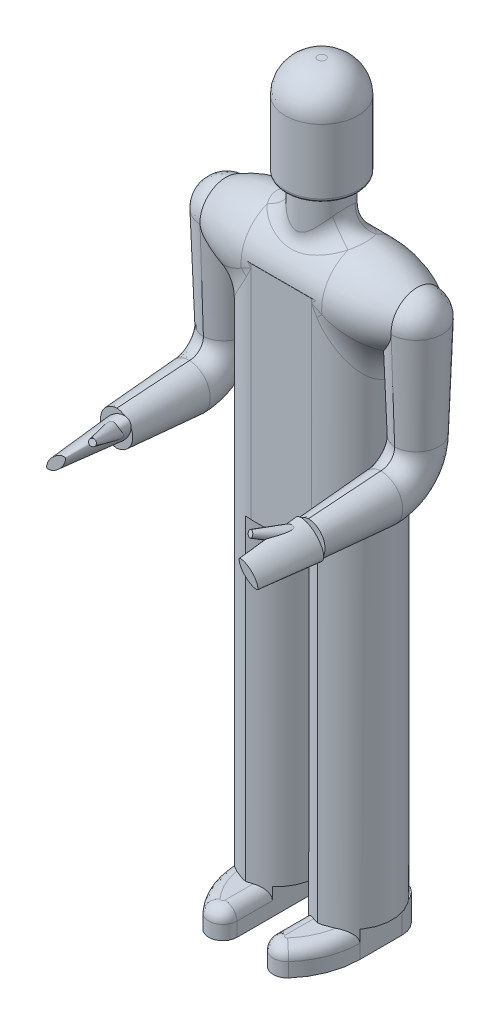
SolidWorks part; units mm, degrees
ref_plane "Front" through (0, 0, 0) normal (0, 0, 1) x (1, 0, 0)
ref_plane "Top" through (0, 0, 0) normal (0, 1, 0) x (1, 0, 0)
ref_plane "Right" through (0, 0, 0) normal (1, 0, 0) x (0, 0, -1)
sketch "Sketch1" plane through (0, 0, 0) normal (0, 1, 0) x (1, 0, 0)
  line L0 (-75, 100) -> (75, 100)
  line L2 (75, -100) -> (-75, -100)
  line L4 (0, -100) -> (0, 100) construction
  arc A0 (75, -100) -> (75, 100) centre (75, 0) ccw
  arc A1 (-75, 100) -> (-75, -100) centre (-75, 0) ccw
  dimension "D2" = 350
  dimension "D1" = 200
extrude "Base-Extrude" add sketch "Sketch1" along normal blind 550
sketch "Sketch3" plane through (0, 0, 0) normal (0, -1, 0) x (1, 0, 0)
  line L2 (-75, -100) -> (75, -100)
  line L3 (75, 100) -> (-75, 100)
  line L4 (-75, -100) -> (75, -100)
  line L5 (75, 100) -> (-75, 100)
  arc A2 (-75, 100) -> (-75, -100) centre (-75, 0) ccw
  arc A3 (75, -100) -> (75, 100) centre (75, 0) ccw
  arc A4 (-75, 100) -> (-75, -100) centre (-75, 0) ccw
  arc A5 (75, -100) -> (75, 100) centre (75, 0) ccw
  dimension "D1" = 0
extrude "Boss-Extrude2" add sketch "Sketch3" along normal blind 850
sketch "Sketch6" plane through (0, 0, 0) normal (1, 0, 0) x (0, 0, -1)
  line L0 (100, -850) -> (-200, -850)
  line L1 (100, -850) -> (100, -785)
  line L2 (-200, -785) -> (100, -785)
  line L3 (-200, -785) -> (-200, -850)
  dimension "D1" = 300
  dimension "D2" = 65
extrude "Boss-Extrude3" add sketch "Sketch6" along normal mid plane 350
sketch "Sketch7" plane through (0, -785, 0) normal (0, 1, 0) x (-1, 0, 0)
  line L0 (0, -100) -> (0, 200) construction
  line L1 (75, -100) -> (-75, -100) construction
  line L2 (-175, 200) -> (175, 200) construction
  line L3 (-45, -45) -> (-45, 165)
  line L4 (-155, 60) -> (-155, -45)
  line L5 (-175, -100) -> (-75, -100) construction
  line L6 (-175, 200) -> (-175, 0) construction
  line L7 (155, 60) -> (155, -45)
  line L8 (45, -45) -> (45, 165)
  line L13 (-185, 210) -> (185, 210)
  line L14 (185, 210) -> (185, -110)
  line L15 (185, -110) -> (-185, -110)
  line L16 (-185, -110) -> (-185, 210)
  line L17 (-185, 210) -> (185, 210)
  line L18 (185, 210) -> (185, -110)
  line L19 (185, -110) -> (-185, -110)
  line L20 (-185, -110) -> (-185, 210)
  arc A0 (-45, 165) -> (-106.1287, 188.2871) centre (-80, 165) ccw
  arc A1 (-45, -45) -> (-155, -45) centre (-100, -45) cw
  arc A2 (-106.1287, 188.2871) -> (-155, 60) centre (37.8125, 60) ccw
  arc A3 (-75, 100) -> (-75, -100) centre (-75, 0) ccw construction
  arc A4 (106.1287, 188.2871) -> (155, 60) centre (-37.8125, 60) cw
  arc A5 (45, -45) -> (155, -45) centre (100, -45) ccw
  arc A6 (45, 165) -> (106.1287, 188.2871) centre (80, 165) cw
  dimension "D3" = 35
  dimension "D1" = 110
  dimension "D2" = 20
  dimension "D4" = 10
extrude "Cut-Extrude5" cut sketch "Sketch7" against normal blind 350
sketch "Sketch8" plane through (0, -785, 0) normal (0, -1, 0) x (1, 0, 0)
  line L0 (182.7532, 150.6065) -> (-185.8298, 150.6065)
  line L1 (182.7532, 150.6065) -> (182.7532, -133.0608)
  line L2 (-185.8298, -133.0608) -> (182.7532, -133.0608)
  line L3 (-185.8298, -133.0608) -> (-185.8298, 150.6065)
  line L4 (0, 60) -> (0, -60) construction
  arc A0 (151.4344, -64.4809) -> (155, 60) centre (75, 0) ccw construction
  arc A1 (151.4344, -64.4809) -> (155, 60) centre (75, 0) ccw
  arc A2 (155, 60) -> (75, 100) centre (75, 0) ccw construction
  arc A3 (155, 60) -> (89.3675, 98.9625) centre (75, 0) ccw
  arc A4 (89.3675, -98.9625) -> (151.4344, -64.4809) centre (75, 0) ccw construction
  arc A5 (96.4627, -97.6696) -> (151.4344, -64.4809) centre (75, 0) ccw
  arc A6 (89.3675, 98.9625) -> (96.4627, -97.6696) centre (110.1372, 1.2679) ccw
  arc A7 (-89.3675, 98.9625) -> (-96.4627, -97.6696) centre (-110.1372, 1.2679) cw
  arc A8 (-96.4627, -97.6696) -> (-151.4344, -64.4809) centre (-75, 0) cw
  arc A9 (-155, 60) -> (-89.3675, 98.9625) centre (-75, 0) cw
  arc A10 (-151.4344, -64.4809) -> (-155, 60) centre (-75, 0) cw
extrude "Cut-Extrude6" cut sketch "Sketch8" against normal blind 785
fillet "Fillet1" radius 30
ref_plane "Plane4" through (0, 540, 0) normal (0, 1, 0) x (-1, 0, 0)
sketch "Sketch9" plane through (0, 540, 0) normal (0, 1, 0) x (-1, 0, 0)
  line L1 (100, -100) -> (-100, -100)
  line L3 (0, -130.4557) -> (0, 0) construction
  line L4 (-52.4051, 0) -> (194.5823, 0) construction
  line L5 (-300, 0) -> (300, 0)
  arc A0 (300, 0) -> (236.9841, -64.7734) centre (235.2021, 0) cw
  arc A1 (236.9841, -64.7734) -> (100, -100) centre (100, 183.9553) cw
  arc A2 (-236.9841, -64.7734) -> (-100, -100) centre (-100, 183.9553) ccw
  arc A3 (66.3333, -88.492) -> (151.4344, -64.4809) centre (100, -45) ccw construction
  arc A4 (-300, 0) -> (-236.9841, -64.7734) centre (-235.2021, 0) ccw
  point P21 (0, 0)
  point P22 (0, -100)
  dimension "D1" = 300
revolve "Boss-Revolve1" add sketch "Sketch9" angle 360 about L4
sketch "Sketch11" plane through (0, 540, 0) normal (0, 1, 0) x (-1, 0, 0)
  line L0 (236.9841, -64.7734) -> (236.9841, 64.7734) construction
  line L1 (0, 0) -> (0, 82.8638) construction
  arc A0 (236.9841, 64.7734) -> (236.9841, -64.7734) centre (242.2143, 0) ccw
  arc A1 (236.9841, -64.7734) -> (236.9841, 64.7734) centre (235.2021, 0) ccw construction
  arc A2 (236.9841, -64.7734) -> (236.9841, 64.7734) centre (235.2021, 0) ccw
  arc A3 (-236.9841, -64.7734) -> (-236.9841, 64.7734) centre (-235.2021, 0) cw
  arc A4 (-236.9841, 64.7734) -> (-236.9841, -64.7734) centre (-242.2143, 0) cw
extrude "Boss-Extrude4" add sketch "Sketch11" against normal blind 250 draft 2
sketch "Sketch12" plane through (0, 290, 0) normal (0, -1, 0) x (1, 0, 0)
  line L0 (-22.4156, 90) -> (21.6005, 90) construction
  arc A6 (237.216, 56.0316) -> (237.216, -56.0316) centre (242.2143, 0) ccw
  arc A7 (237.216, -56.0316) -> (237.216, 56.0316) centre (235.2021, 0) ccw
  arc A8 (237.216, 56.0316) -> (237.216, -56.0316) centre (242.2143, 0) ccw
  arc A9 (237.216, -56.0316) -> (237.216, 56.0316) centre (235.2021, 0) ccw
  dimension "D3" = 90
  dimension "D2" = 0
revolve "Boss-Revolve2" add sketch "Sketch12" angle 90 about L0
mirror "Mirror1" about plane through (0, 0, 0) normal (1, 0, 0)
sketch "Sketch13" plane through (0, 0, 90) normal (0, 0, 1) x (1, 0, 0)
  arc A2 (-237.216, 256.0316) -> (-237.216, 143.9684) centre (-235.2021, 200) ccw
  arc A3 (-237.216, 143.9684) -> (-237.216, 256.0316) centre (-242.2143, 200) ccw
  arc A4 (-237.216, 256.0316) -> (-237.216, 143.9684) centre (-235.2021, 200) ccw
  arc A5 (-237.216, 143.9684) -> (-237.216, 256.0316) centre (-242.2143, 200) ccw
  arc A6 (237.216, 143.9684) -> (237.216, 256.0316) centre (235.2021, 200) ccw
  arc A7 (237.216, 256.0316) -> (237.216, 143.9684) centre (242.2143, 200) ccw
  arc A8 (237.216, 143.9684) -> (237.216, 256.0316) centre (235.2021, 200) ccw
  arc A9 (237.216, 256.0316) -> (237.216, 143.9684) centre (242.2143, 200) ccw
  dimension "D1" = 0
  dimension "D2" = 0
extrude "Boss-Extrude5" add sketch "Sketch13" along normal blind 180 draft 4
fillet "Fillet2" radius 100
ref_plane "Plane5" through (0, 590, 0) normal (0, 1, 0) x (-1, 0, 0)
sketch "Sketch15" plane through (0, 590, 0) normal (0, 1, 0) x (-1, 0, 0)
  circle A0 centre (0, 0) radius 62.5
  dimension "D1" = 125
extrude "Hals" add sketch "Sketch15" along normal blind 140
sketch "Sketch17" plane through (0, 0, 0) normal (0, 0, 1) x (1, 0, 0)
  line L0 (0, 730) -> (0, 997.589) construction
  line L1 (0, 772.3401) -> (0, 645.3197) construction
  line L2 (0, 730) -> (90, 730)
  line L3 (0, 730) -> (0, 980)
  line L4 (90, 980) -> (0, 980)
  line L5 (90, 980) -> (90, 730)
  line L6 (62.5, 730) -> (-62.5, 730) construction
  dimension "D1" = 90
  dimension "D2" = 250
revolve "Hoved" add sketch "Sketch17" angle 360 about L0
fillet "Fillet3" radius 10
fillet "Fillet6" radius 80
fillet "Fillet7" radius 50
sketch "Sketch18" plane through (0, 0, 270) normal (0, 0, 1) x (1, 0, 0)
  line L0 (238.7082, 200) -> (226.9606, 188.2524) construction
  line L1 (235.2021, 200) -> (242.2143, 200) construction
  line L2 (242.2143, 596.7948) -> (242.2143, 426.4105) construction
  line L3 (235.2021, 203.5061) -> (242.2143, 196.4939) construction
  line L5 (235.2021, 535.4799) -> (235.2021, 290) construction
  ellipse E0 centre (238.7082, 200) end of major axis (270.528, 168.1802) minor radius 25
  dimension "D1" = 90
  dimension "D2" = 50
  dimension "D3" = 45
extrude "Boss-Extrude8" add sketch "Sketch18" along normal blind 150 draft 5
sketch "Sketch19" plane through (0, 0, 270) normal (0, 0, 1) x (1, 0, 0)
  line L0 (242.1635, 196.5446) -> (250.8932, 205.2743) construction
  line L1 (238.7082, 200) -> (226.9606, 188.2524) construction
  line L2 (238.7082, 200) -> (242.1635, 196.5446) construction
  dimension "D1" = 4.8866
ref_plane "Plane6" through (-69.0522, 69.0522, 209.421) normal (-0.2988, 0.2988, 0.9063) x (0.9479, -0.0172, 0.3182)
sketch "Sketch20" plane through (-69.0522, 69.0522, 209.421) normal (-0.2988, 0.2988, 0.9063) x (0.9479, -0.0172, 0.3182)
  line L0 (308.7377, 142.1631) -> (312.0724, 139.2487) construction
  circle A0 centre (300.1451, 148.3448) radius 22.5
  dimension "D1" = 1
  dimension "D2" = 45
  dimension "D3" = 15
extrude "Boss-Extrude9" add sketch "Sketch20" along normal blind 120 draft 7
mirror "Mirror2" about plane through (0, 0, 0) normal (1, 0, 0)
